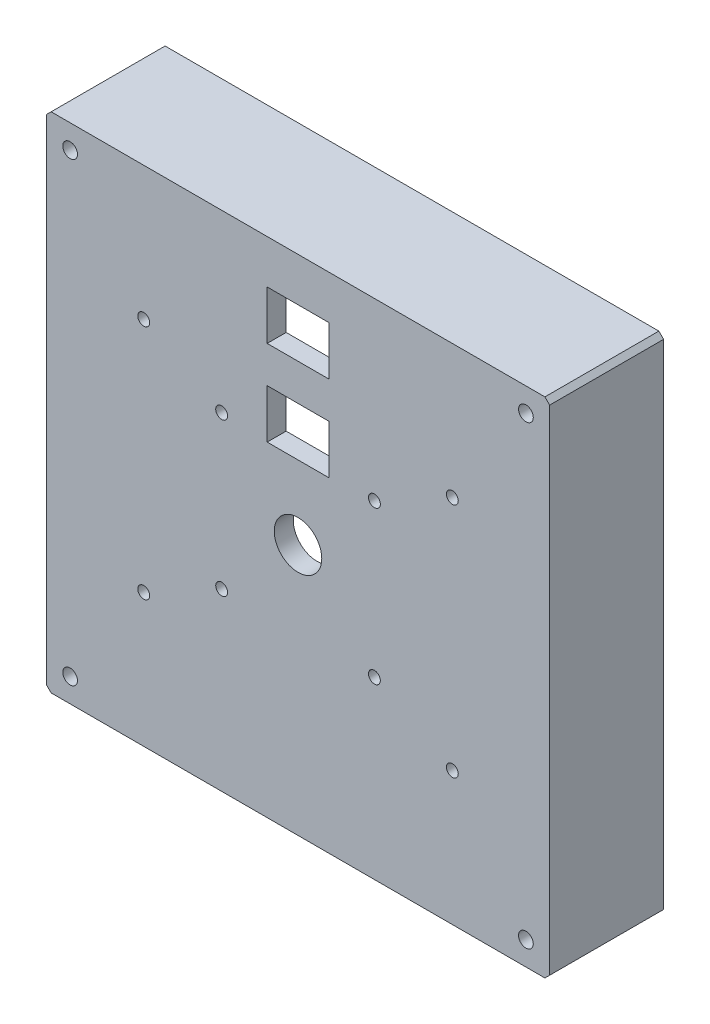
SolidWorks part; units mm, degrees
ref_plane "Front Plane" through (0, 0, 0) normal (0, 0, 1) x (1, 0, 0)
ref_plane "Top Plane" through (0, 0, 0) normal (0, 1, 0) x (1, 0, 0)
ref_plane "Right Plane" through (0, 0, 0) normal (1, 0, 0) x (0, 0, -1)
sketch "Sketch1" plane through (0, 0, 0) normal (0, 0, 1) x (1, 0, 0)
  line L0 (0, 43) -> (0, -43) construction
  line L1 (-53, 53) -> (53, 53)
  line L2 (-53, 53) -> (-53, -53)
  line L3 (-53, -53) -> (53, -53)
  line L4 (53, 53) -> (53, -53)
  line L5 (-43, 0) -> (43, 0) construction
  point P5 (-53, 0)
  point P7 (0, 53)
  dimension "D1" = 106
  dimension "D2" = 106
extrude "Boss-Extrude1" add sketch "Sketch1" against normal blind 4
sketch "Sketch2" plane through (0, 0, -4) normal (0, 0, -1) x (-1, 0, 0)
  line L0 (53, 53) -> (53, -53) construction
  line L1 (-53, 53) -> (53, 53)
  line L2 (-53, 53) -> (-53, -53)
  line L3 (-53, -53) -> (53, -53)
  line L4 (53, 53) -> (53, -53)
  line L5 (-48, 41) -> (-48, -41)
  line L10 (-48, -41) -> (-41, -48)
  line L11 (-41, -48) -> (41, -48)
  line L12 (41, -48) -> (48, -41)
  line L13 (48, -41) -> (48, 41)
  line L14 (48, 41) -> (41, 48)
  line L15 (41, 48) -> (-41, 48)
  line L16 (-41, 48) -> (-48, 41)
  dimension "D1" = 5
  dimension "D2" = 5
  dimension "D3" = 5
  dimension "D4" = 5
  dimension "D5" = 12
  dimension "D6" = 12
  dimension "D7" = 12
  dimension "D8" = 12
  dimension "D9" = 12
extrude "Boss-Extrude2" add sketch "Sketch2" along normal blind 20
sketch "Sketch6" plane through (0, 0, 0) normal (0, 0, 1) x (1, 0, 0)
  line L1 (-53, 53) -> (53, 53)
  line L2 (-53, 53) -> (-53, -53)
  line L3 (-53, -53) -> (53, -53)
  line L4 (53, 53) -> (53, -53)
  circle A0 centre (0, 0) radius 48
  dimension "D1" = 96
sketch "Sketch7" plane through (0, 0, 0) normal (0, 0, 1) x (1, 0, 0)
  line L1 (-53, 53) -> (53, 53) construction
  line L2 (-53, 53) -> (-53, -53) construction
  line L3 (-53, -53) -> (53, -53) construction
  line L4 (53, 53) -> (53, -53) construction
  circle A0 centre (-48, 48) radius 1.55
  circle A1 centre (48, 48) radius 1.55
  circle A2 centre (-48, -48) radius 1.55
  circle A3 centre (48, -48) radius 1.55
  dimension "D1" = 5
  dimension "D3" = 3.1
  dimension "D6" = 3.1
  dimension "D9" = 3.1
  dimension "D12" = 3.1
  dimension "D2" = 5
  dimension "D4" = 5
  dimension "D5" = 5
  dimension "D7" = 5
  dimension "D8" = 5
  dimension "D10" = 5
  dimension "D11" = 5
extrude "Cut-Extrude2" cut sketch "Sketch7" against normal blind 50
sketch "Sketch8" plane through (0, 0, 0) normal (0, 0, 1) x (1, 0, 0)
  line L0 (-16.0867, -16.0867) -> (16.0867, 16.0867) construction
  line L1 (-6.5, 43.8) -> (6.5, 43.8)
  line L2 (-6.5, 43.8) -> (-6.5, 33.5)
  line L3 (-6.5, 33.5) -> (6.5, 33.5)
  line L4 (6.5, 43.8) -> (6.5, 33.5)
  line L5 (-6.5, 25.8) -> (6.5, 25.8)
  line L6 (-6.5, 25.8) -> (-6.5, 15.5)
  line L7 (-6.5, 15.5) -> (6.5, 15.5)
  line L8 (6.5, 25.8) -> (6.5, 15.5)
  line L9 (-16.0867, 16.0867) -> (16.0867, -16.0867) construction
  line L10 (0, 53) -> (0, -53) construction
  line L11 (-53, 53) -> (53, 53) construction
  line L12 (-53, 53) -> (-53, -53) construction
  line L13 (-53, -53) -> (53, -53) construction
  line L14 (53, 53) -> (53, -53) construction
  line L15 (13.2, 0) -> (-13.2, 0) construction
  line L16 (-4.5, 23.8) -> (4.5, 23.8) construction
  line L17 (-4.5, 23.8) -> (-4.5, 21.5) construction
  line L18 (-4.5, 21.5) -> (4.5, 21.5) construction
  line L19 (4.5, 23.8) -> (4.5, 21.5) construction
  line L20 (-4.5, 41.8) -> (4.5, 41.8) construction
  line L21 (-4.5, 41.8) -> (-4.5, 39.5) construction
  line L22 (-4.5, 39.5) -> (4.5, 39.5) construction
  line L23 (4.5, 41.8) -> (4.5, 39.5) construction
  line L24 (-32.5, 24.9) -> (32.5, 24.9) construction
  line L25 (-32.5, 24.9) -> (-32.5, -24.9) construction
  line L26 (-32.5, -24.9) -> (32.5, -24.9) construction
  line L27 (32.5, 24.9) -> (32.5, -24.9) construction
  line L28 (-53, 0) -> (53, 0) construction
  circle A0 centre (32.5, 24.9) radius 1.25
  circle A1 centre (-32.5, 24.9) radius 1.25
  circle A2 centre (-32.5, -24.9) radius 1.25
  circle A3 centre (32.5, -24.9) radius 1.25
  circle A4 centre (16.0867, -16.0867) radius 1.25
  circle A5 centre (-16.0867, -16.0867) radius 1.25
  circle A6 centre (16.0867, 16.0867) radius 1.25
  circle A7 centre (-16.0867, 16.0867) radius 1.25
  circle A8 centre (0, 0) radius 5
  point P22 (32.5, 0)
  point P25 (-32.5, 0)
  dimension "D6" = 2.5
  dimension "D7" = 2.5
  dimension "D8" = 2.5
  dimension "D9" = 2.5
  dimension "D10" = 2.5
  dimension "D11" = 2.5
  dimension "D12" = 2.5
  dimension "D13" = 2.5
  dimension "D22" = 10
  dimension "D1" = 65
  dimension "D2" = 49.8
  dimension "D3" = 45.5
  dimension "D4" = 45.5
  dimension "D5" = 45
  dimension "D14" = 2
  dimension "D15" = 6
  dimension "D16" = 2
  dimension "D17" = 2
  dimension "D18" = 2
  dimension "D19" = 6
  dimension "D20" = 2
  dimension "D21" = 2
extrude "Cut-Extrude3" cut sketch "Sketch8" against normal blind 10
sketch "Sketch9" plane through (0, 0, -4) normal (0, 0, 1) x (1, 0, 0)
  line L0 (0, 46) -> (0, -46) construction
  line L1 (-53, 53) -> (53, 53) construction
  line L2 (-53, 53) -> (-53, -53) construction
  line L3 (-53, -53) -> (53, -53) construction
  line L4 (53, 53) -> (53, -53) construction
  line L5 (-39.5, 46) -> (39.5, 46) construction
  line L6 (-39.5, 46) -> (-39.5, -46) construction
  line L7 (-39.5, -46) -> (39.5, -46) construction
  line L8 (39.5, 46) -> (39.5, -46) construction
  line L9 (-39.5, 0) -> (39.5, 0) construction
  line L18 (37.4, 39.7988) -> (35.7012, 38.1)
  line L19 (-35.7012, 38.1) -> (-33.2988, 38.1)
  line L20 (-33.2988, 38.1) -> (-31.6, 39.7988)
  line L21 (-31.6, 39.7988) -> (-31.6, 42.2012)
  line L22 (-31.6, 42.2012) -> (-33.2988, 43.9)
  line L23 (-33.2988, 43.9) -> (-35.7012, 43.9)
  line L24 (-35.7012, 43.9) -> (-37.4, 42.2012)
  line L25 (-37.4, 42.2012) -> (-37.4, 39.7988)
  line L26 (-37.4, 39.7988) -> (-35.7012, 38.1)
  line L27 (37.4, 42.2012) -> (37.4, 39.7988)
  line L28 (35.7012, 43.9) -> (37.4, 42.2012)
  line L29 (33.2988, 43.9) -> (35.7012, 43.9)
  line L30 (31.6, 42.2012) -> (33.2988, 43.9)
  line L31 (31.6, 39.7988) -> (31.6, 42.2012)
  line L32 (33.2988, 38.1) -> (31.6, 39.7988)
  line L33 (35.7012, 38.1) -> (33.2988, 38.1)
  line L34 (35.7012, -38.1) -> (33.2988, -38.1)
  line L35 (33.2988, -38.1) -> (31.6, -39.7988)
  line L36 (31.6, -39.7988) -> (31.6, -42.2012)
  line L37 (31.6, -42.2012) -> (33.2988, -43.9)
  line L38 (33.2988, -43.9) -> (35.7012, -43.9)
  line L39 (35.7012, -43.9) -> (37.4, -42.2012)
  line L40 (37.4, -42.2012) -> (37.4, -39.7988)
  line L41 (37.4, -39.7988) -> (35.7012, -38.1)
  line L42 (-37.4, -39.7988) -> (-35.7012, -38.1)
  line L43 (-37.4, -42.2012) -> (-37.4, -39.7988)
  line L44 (-35.7012, -43.9) -> (-37.4, -42.2012)
  line L45 (-33.2988, -43.9) -> (-35.7012, -43.9)
  line L46 (-31.6, -42.2012) -> (-33.2988, -43.9)
  line L47 (-31.6, -39.7988) -> (-31.6, -42.2012)
  line L48 (-33.2988, -38.1) -> (-31.6, -39.7988)
  line L49 (-35.7012, -38.1) -> (-33.2988, -38.1)
  circle A0 centre (-34.5, 41) radius 4.5
  circle A4 centre (-34.5, 41) radius 2.9 construction
  circle A5 centre (34.5, 41) radius 4.5
  circle A6 centre (34.5, -41) radius 4.5
  circle A7 centre (-34.5, -41) radius 2.9 construction
  circle A8 centre (-34.5, -41) radius 4.5
  dimension "D1" = 9
  dimension "D2" = 13.5
  dimension "D3" = 13.5
  dimension "D4" = 7
  dimension "D5" = 7
  dimension "D6" = 5
  dimension "D7" = 5
  dimension "D8" = 5.8
extrude "Boss-Extrude3" add sketch "Sketch9" against normal blind 4
sketch "Sketch14" plane through (0, -53, 0) normal (0, -1, 0) x (1, 0, 0)
  line L0 (0, 0) -> (0, -24) construction
  line L5 (-53, 0) -> (53, 0) construction
  line L6 (-53, 0) -> (-53, -24) construction
  line L7 (-53, -24) -> (53, -24) construction
  line L8 (53, 0) -> (53, -24) construction
  line L10 (-6.5, -10.83) -> (6.5, -10.83) construction
  line L13 (-6.5, -6.83) -> (6.5, -6.83)
  line L14 (-6.5, -6.83) -> (-6.5, -14.83)
  line L15 (-6.5, -14.83) -> (6.5, -14.83)
  line L16 (6.5, -6.83) -> (6.5, -14.83)
  circle A0 centre (-20, -10.83) radius 2.5
  point P10 (-6.5, -10.83)
  point P13 (6.5, -10.83)
  point P14 (0, -14.83)
  point P19 (0, 0)
  point P21 (-16.841, -11.749)
  dimension "D4" = 5
  dimension "D1" = 10.83
  dimension "D2" = 13
  dimension "D3" = 8
  dimension "D5" = 20
  dimension "D6" = 10.83
extrude "Cut-Extrude4" cut sketch "Sketch14" against normal blind 10
chamfer "Chamfer1" distance 1 4 edges at (53, 53, -12) (-53, 53, -12) (-53, -53, -12) (53, -53, -12)
chamfer "Chamfer2" distance 1 4 edges at (0, -53, -6.83) (6.5, -53, -10.83) (0, -53, -14.83) (-6.5, -53, -10.83)
sketch "Sketch15" plane through (48, 0, 0) normal (-1, 0, 0) x (0, 0, 1)
  line L0 (-12, -53) -> (-12, 53) construction
  line L1 (0, -53) -> (-24, -53) construction
  line L2 (0, -53) -> (0, 53) construction
  line L3 (0, 53) -> (-24, 53) construction
  line L4 (-24, -53) -> (-24, 53) construction
  circle A0 centre (-12, -23) radius 1.6
  circle A1 centre (-12, 23) radius 1.6
  dimension "D1" = 3.2
  dimension "D2" = 3.2
  dimension "D3" = 30
  dimension "D4" = 30
extrude "Cut-Extrude5" cut sketch "Sketch15" against normal blind 1 and the other way blind 97
chamfer "Chamfer3" distance 1 angle 45 2 edges at (-20, -48, -8.33) (-17.5, -53, -10.83)
